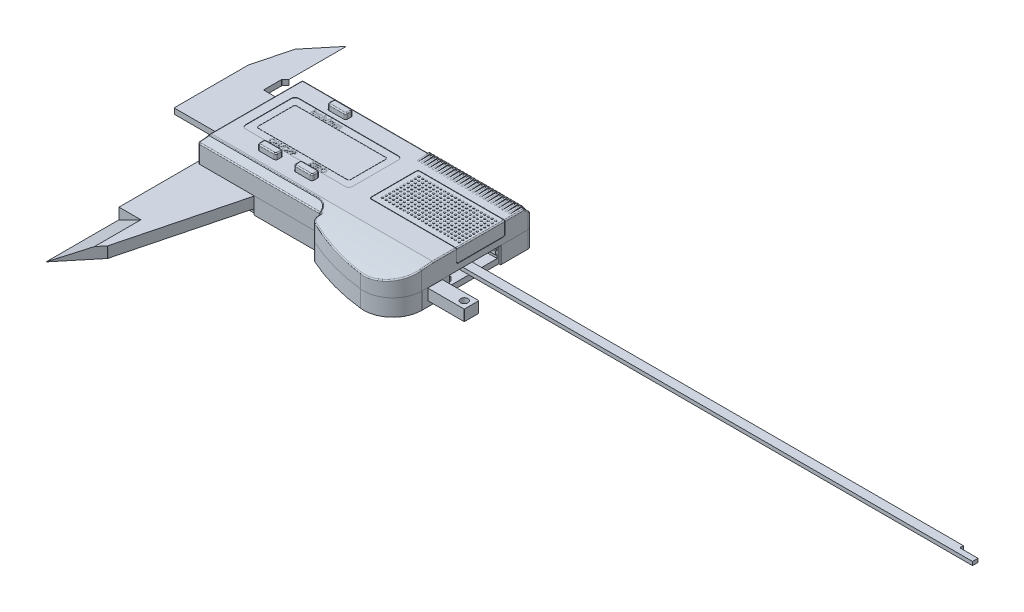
SolidWorks part; units mm, degrees
ref_plane "Front Plane" through (0, 0, 0) normal (0, 0, 1) x (1, 0, 0)
ref_plane "Top Plane" through (0, 0, 0) normal (0, 1, 0) x (1, 0, 0)
ref_plane "Right Plane" through (0, 0, 0) normal (1, 0, 0) x (0, 0, -1)
sketch "Sketch1" plane through (0, 0, 0) normal (0, 1, 0) x (1, 0, 0)
  line L0 (0, -2) -> (0, -13.5)
  line L1 (0, -13.5) -> (-1, -14.5)
  line L2 (-1, -14.5) -> (-1, -56.1)
  line L3 (-1, -56.1) -> (6.6336, -46.841)
  line L4 (6.6336, -46.841) -> (15, -14.5)
  line L5 (15, -14.5) -> (60, -14.5)
  line L6 (60, -14.5) -> (60, 14.5)
  line L7 (5.0002, 1.25) -> (18.5063, 1.25) construction
  line L8 (5.0002, -1.25) -> (18.5063, -1.25) construction
  line L9 (0, -2) -> (-20, -2)
  line L10 (-17.3613, 28.4842) -> (-20, 18.2842)
  line L11 (-20, -2) -> (-20, 18.2842)
  line L12 (-17.3613, 28.4842) -> (-11, 36.2)
  line L13 (-11, 36.2) -> (-11, 20.5)
  line L14 (-11, 20.5) -> (-12, 19.5)
  line L15 (60, 0) -> (0, 0) construction
  line L16 (60, 6.1) -> (-24.4785, 6.1) construction
  line L17 (-24.4785, 6.1) -> (-24.4785, -6.1) construction
  line L18 (-24.4785, -6.1) -> (60, -6.1) construction
  line L19 (-12, 19.5) -> (-12, 14.5)
  line L20 (-12, 14.5) -> (60, 14.5)
  dimension "D1" = 12.2
  dimension "D2" = 6.1
  dimension "D3" = 50
  dimension "D4" = 2.5
  dimension "D5" = 12
  dimension "D6" = 1
  dimension "D7" = 135
  dimension "D8" = 1.25
  dimension "D9" = 7.4
  dimension "D10" = 15
  dimension "D11" = 155
  dimension "D12" = 2
  dimension "D13" = 29
  dimension "D14" = 45
  dimension "D15" = 135
  dimension "D16" = 1
  dimension "D17" = 10
  dimension "D18" = 155
  dimension "D19" = 15.7
  dimension "D20" = 5
  dimension "D21" = 8
  dimension "D22" = 10
extrude "Boss-Extrude1" add sketch "Sketch1" along normal blind 5
sketch "Sketch2" plane through (0, 5, 0) normal (0, 1, 0) x (1, 0, 0)
  line L0 (0, -2) -> (0, 14.5)
  line L15 (0, -13.5) -> (-1, -14.5)
  line L16 (-1, -14.5) -> (-1, -56.1)
  line L17 (-1, -56.1) -> (6.6336, -46.841)
  line L18 (6.6336, -46.841) -> (15, -14.5)
  line L19 (15, -14.5) -> (60, -14.5)
  line L20 (60, -14.5) -> (60, 14.5)
  line L21 (60, 14.5) -> (-12, 14.5)
  line L22 (-12, 14.5) -> (-12, 19.5)
  line L23 (-12, 19.5) -> (-11, 20.5)
  line L24 (-11, 20.5) -> (-11, 36.2)
  line L25 (-11, 36.2) -> (-17.3613, 28.4842)
  line L26 (-17.3613, 28.4842) -> (-20, 18.2842)
  line L27 (-20, 18.2842) -> (-20, -2)
  line L28 (-20, -2) -> (0, -2)
  line L29 (0, -2) -> (0, -13.5)
  line L36 (0, 14.5) -> (-12, 14.5)
  line L37 (-12, 14.5) -> (-12, 19.5)
  line L38 (-12, 19.5) -> (-11, 20.5)
  line L39 (-11, 20.5) -> (-11, 36.2)
  line L40 (-11, 36.2) -> (-17.3613, 28.4842)
  line L41 (-17.3613, 28.4842) -> (-20, 18.2842)
  line L42 (-20, 18.2842) -> (-20, -2)
  line L43 (-20, -2) -> (0, -2)
  dimension "D1" = 0
extrude "Cut-Extrude1" cut sketch "Sketch2" against normal blind 3.5
sketch "Sketch3" plane through (60, 0, 0) normal (1, 0, 0) x (0, 0, -1)
  line L0 (0, 8.3658) -> (0, -4.7118) construction
  line L1 (-14.5, 5) -> (14.5, 5) construction
  line L2 (6.5, 1.5) -> (-6.5, 1.5)
  line L3 (6.5, 1.5) -> (6.5, 2.5)
  line L4 (6.5, 4.5) -> (-6.5, 4.5)
  line L5 (-6.5, 1.5) -> (-6.5, 2.5)
  line L6 (6.5, 1.5) -> (-6.5, 4.5) construction
  line L7 (6.5, 4.5) -> (-6.5, 1.5) construction
  line L8 (-6.1, 3) -> (0, 3) construction
  line L9 (-6.5, 3.5) -> (-6.1, 3.5)
  line L10 (6.5, 3.5) -> (6.5, 4.5)
  line L11 (-6.5, 2.5) -> (-6.1, 2.5)
  line L12 (-6.1, 3.5) -> (-6.1, 2.5)
  line L13 (6.5, 3.5) -> (6.1, 3.5)
  line L15 (6.5, 2.5) -> (6.1, 2.5)
  line L16 (6.1, 3.5) -> (6.1, 2.5)
  line L17 (0, 3) -> (6.1, 3) construction
  line L18 (-6.5, 3.5) -> (-6.5, 4.5)
  point P3 (0, 3)
  dimension "D1" = 3
  dimension "D2" = 13
  dimension "D3" = 0.5
  dimension "D4" = 0.4
  dimension "D5" = 0.4
  dimension "D6" = 1
  dimension "D7" = 1
extrude "Cut-Extrude2" cut sketch "Sketch3" against normal through all
fillet "Fillet1" radius 0.1 10 edges at (15, 2.5, 14.5) (6.6336, 2.5, 46.841) (-1, 2.5, 14.5) (0, 2.5, 13.5) (-20, 0.75, 2) (-12, 0.75, -14.5) (-20, 0.75, -18.2842) (-17.3613, 0.75, -28.4842) (-11, 0.75, -20.5) (-12, 0.75, -19.5)
ref_plane "Plane1" through (0, 0, 56.1) normal (0, 0, 1) x (1, 0, 0)
ref_plane "Plane2" through (0, 0, 36.1) normal (0, 0, 1) x (1, 0, 0)
ref_plane "Plane3" through (0, 0, -36.2) normal (0, 0, -1) x (-1, 0, 0)
ref_plane "Plane4" through (0, 0, -20.5) normal (0, 0, -1) x (-1, 0, 0)
sketch "Sketch5" plane through (0, 0, -20.5) normal (0, 0, -1) x (-1, 0, 0)
  line L0 (17.3472, 0) -> (11, 1.5)
  line L1 (11, 1.5) -> (11, 0)
  line L2 (11, 0) -> (17.3472, 0)
extrude "Cut-Extrude4" cut sketch "Sketch5" along normal through all
sketch "Sketch6" plane through (60, 0, 0) normal (1, 0, 0) x (0, 0, -1)
  line L0 (-14.5, 5) -> (-14.5, 0) construction
  line L1 (-14.5, 1.5) -> (-60.6201, 1.5)
  line L2 (-14.5, 1.5) -> (-14.5, -3.4615)
  line L3 (-14.5, -3.4615) -> (-60.6201, -3.4615)
  line L4 (-60.6201, 1.5) -> (-60.6201, -3.4615)
  line L5 (-14.5, 0) -> (14.5, 0) construction
  dimension "D1" = 1.5
extrude "Cut-Extrude5" cut sketch "Sketch6" against normal through all
fillet "Fillet2" radius 1 1 edges at (7.0432, 1.5, 14.5)
sketch "Sketch7" plane through (60, 0, 0) normal (1, 0, 0) x (0, 0, -1)
  line L0 (-14.5, 5) -> (-14.5, 0) construction
  line L1 (-14.5, 4.5) -> (-62.5532, 4.5)
  line L2 (-14.5, 4.5) -> (-14.5, 9.8508)
  line L3 (-14.5, 9.8508) -> (-62.5532, 9.8508)
  line L4 (-62.5532, 4.5) -> (-62.5532, 9.8508)
  line L5 (-46.8196, 5) -> (-14.575, 5) construction
  dimension "D1" = 0.5
extrude "Cut-Extrude6" cut sketch "Sketch7" against normal through all
sketch "Sketch8" plane through (0, 0, 36.1) normal (0, 0, 1) x (1, 0, 0)
  line L0 (-1, 1.5) -> (5, 4.5)
  line L1 (-0.991, 4.5) -> (15.0774, 4.5) construction
  line L2 (5, 4.5) -> (-1, 4.5)
  line L3 (-1, 4.5) -> (-1, 1.5)
  dimension "D1" = 6
extrude "Cut-Extrude7" cut sketch "Sketch8" along normal through all
sketch "Sketch9" plane through (60, 0, 0) normal (1, 0, 0) x (0, 0, -1)
  line L0 (0, 0) -> (0, 10.746) construction
  line L1 (-14.5, 0) -> (14.5, 0) construction
  line L2 (-14.5, 5) -> (14.5, 5) construction
  line L3 (-4.5, 5) -> (4.6, 5)
  line L4 (-4.5, 5) -> (-4.5, 4.5)
  line L5 (-4.5, 4.5) -> (4.6, 4.5)
  line L6 (4.6, 5) -> (4.6, 4.5)
  line L7 (6.5, 4.5) -> (-6.5, 4.5) construction
  dimension "D1" = 9.1
  dimension "D2" = 4.6
extrude "Cut-Extrude8" cut sketch "Sketch9" against normal through all
sketch "Sketch10" plane through (0, 1.5, 0) normal (0, 1, 0) x (1, 0, 0)
  line L0 (0, 0) -> (10.7209, 0) construction
  line L1 (0, 6.5) -> (0, 14.5) construction
  line L2 (8, 1.25) -> (193, 1.25)
  line L3 (8, 1.25) -> (8, -1.25)
  line L4 (8, -1.25) -> (198, -1.25)
  line L5 (198, 0.25) -> (198, -1.25)
  line L6 (198, 0.25) -> (193.3, 0.25)
  line L7 (193, 0.55) -> (193, 1.25)
  arc A0 (193.3, 0.25) -> (193, 0.55) centre (193.3, 0.55) cw
  dimension "D5" = 0.3
  dimension "D1" = 2.5
  dimension "D2" = 1.25
  dimension "D3" = 8
  dimension "D4" = 190
  dimension "D6" = 5
  dimension "D7" = 1.5
extrude "Boss-Extrude2" add sketch "Sketch10" along normal blind 1
sketch "Sketch11" plane through (0, 0, -14.5) normal (0, 0, -1) x (-1, 0, 0)
  line L1 (1, 4.5) -> (0, 4.5)
  line L2 (1, 4.5) -> (1, 5)
  line L3 (1, 5) -> (0, 5)
  line L4 (0, 4.5) -> (0, 5)
extrude "Cut-Extrude9" cut sketch "Sketch11" against normal through all
ref_plane "Plane5" through (0, 10, 0) normal (0, 1, 0) x (1, 0, 0)
sketch "Sketch12" plane through (0, 10, 0) normal (0, 1, 0) x (1, 0, 0)
  line L0 (-0.5, 14.5) -> (-0.5, -14.5)
  line L2 (0, -15) -> (33.2977, -15)
  line L3 (33.2977, -15) -> (33.2977, -16)
  line L4 (60.5, -14.7287) -> (60.5, 14.5)
  line L5 (59.5, 15.5) -> (40, 15.5)
  line L6 (40, 15.5) -> (39.5, 15)
  line L7 (39.5, 15) -> (24.5, 15)
  line L8 (24.5, 15) -> (24, 15.5)
  line L9 (24, 15.5) -> (0.5, 15.5)
  line L11 (0, 6.5) -> (0, 14.5) construction
  line L13 (0, 14.5) -> (0, 4.6) construction
  line L14 (60, -14.5) -> (60, -4.5) construction
  line L15 (0, -14.5) -> (60, -14.5) construction
  line L16 (60, 14.5) -> (0, 14.5) construction
  arc A0 (34.4754, -17.8231) -> (51.6182, -22.516) centre (57.9128, 34.1354) ccw
  arc A1 (51.6182, -22.516) -> (60.5, -14.7287) centre (52.5017, -14.5649) ccw
  arc A2 (33.2977, -16) -> (34.4754, -17.8231) centre (35.2977, -16) ccw
  arc A3 (60.5, 14.5) -> (59.5, 15.5) centre (59.5, 14.5) ccw
  arc A4 (0.5, 15.5) -> (-0.5, 14.5) centre (0.5, 14.5) ccw
  arc A5 (-0.5, -14.5) -> (0, -15) centre (0, -14.5) ccw
  dimension "D4" = 2
  dimension "D5" = 57
  dimension "D6" = 8
  dimension "D10" = 1
  dimension "D11" = 0.5
  dimension "D1" = 0.5
  dimension "D2" = 0.5
  dimension "D3" = 0.5
  dimension "D7" = 1
  dimension "D8" = 0.5
  dimension "D9" = 45
  dimension "D12" = 15
  dimension "D13" = 25
  dimension "D14" = 1
extrude "Boss-Extrude3" add sketch "Sketch12" against normal offset from surface (5.4 mm away) 0.1 separate body
sketch "Sketch13" plane through (0, 4.6, 0) normal (0, -1, 0) x (1, 0, 0)
  line L2 (-0.5, -14.5) -> (60.5, -14.5)
  line L3 (14.8707, 15) -> (15, 14.5)
  line L4 (-0.991, 14.5) -> (60, 14.5) construction
  line L5 (15, 14.5) -> (60.5, 14.5)
  line L9 (60.5, -14.5) -> (60.5, 14.7287)
  line L10 (33.2977, 16) -> (33.2977, 15)
  line L11 (33.2977, 15) -> (0, 15)
  line L12 (-0.5, 14.5) -> (-0.5, -14.5)
  line L13 (0.5, -15.5) -> (24, -15.5)
  line L14 (24, -15.5) -> (24.5, -15)
  line L15 (24.5, -15) -> (39.5, -15)
  line L16 (39.5, -15) -> (40, -15.5)
  line L17 (40, -15.5) -> (59.5, -15.5)
  line L18 (60.5, 14.5) -> (60.5, 14.7287)
  line L19 (33.2977, 16) -> (33.2977, 15)
  line L20 (33.2977, 15) -> (14.8707, 15)
  line L22 (0.5, -15.5) -> (24, -15.5)
  line L23 (24, -15.5) -> (24.5, -15)
  line L24 (24.5, -15) -> (39.5, -15)
  line L25 (39.5, -15) -> (40, -15.5)
  line L26 (40, -15.5) -> (59.5, -15.5)
  arc A6 (59.5, -15.5) -> (60.5, -14.5) centre (59.5, -14.5) ccw
  arc A7 (60.5, 14.7287) -> (51.6182, 22.516) centre (52.5017, 14.5649) ccw
  arc A8 (51.6182, 22.516) -> (34.4754, 17.8231) centre (57.9128, -34.1354) ccw
  arc A9 (34.4754, 17.8231) -> (33.2977, 16) centre (35.2977, 16) ccw
  arc A10 (0, 15) -> (-0.5, 14.5) centre (0, 14.5) ccw
  arc A11 (-0.5, -14.5) -> (0.5, -15.5) centre (0.5, -14.5) ccw
  arc A12 (59.5, -15.5) -> (60.5, -14.5) centre (59.5, -14.5) ccw
  arc A13 (60.5, 14.7287) -> (51.6182, 22.516) centre (52.5017, 14.5649) ccw
  arc A14 (51.6182, 22.516) -> (34.4754, 17.8231) centre (57.9128, -34.1354) ccw
  arc A15 (34.4754, 17.8231) -> (33.2977, 16) centre (35.2977, 16) ccw
  arc A17 (-0.5, -14.5) -> (0.5, -15.5) centre (0.5, -14.5) ccw
  dimension "D1" = 0
extrude "Boss-Extrude4" add sketch "Sketch13" along normal up to surface (4.6 mm away) separate body
sketch "Sketch14" plane through (0, 4.6, 0) normal (0, -1, 0) x (1, 0, 0)
  line L1 (60.5, 14.5) -> (60.0034, 14.5)
  line L2 (60.5, 14.5) -> (60.5, 7)
  line L3 (60.5, 7) -> (60.0034, 7)
  line L4 (60.0034, 14.5) -> (60.0034, 7)
  line L5 (60.5, -14.5) -> (60.0034, -14.5)
  line L6 (60.5, -14.5) -> (60.5, -7)
  line L7 (60.5, -7) -> (60.0034, -7)
  line L8 (60.0034, -14.5) -> (60.0034, -7)
  dimension "D1" = 7.5
  dimension "D2" = 7.5
extrude "Boss-Extrude5" add sketch "Sketch14" along normal up to surface (4.6 mm away) separate body
sketch "Sketch15" plane through (-0.5, 0, 0) normal (-1, 0, 0) x (0, 0, 1)
  line L0 (-15.5, 8) -> (-13.5, 10)
  line L1 (-15.5, 4.6) -> (-15.5, 10) construction
  line L2 (-14.5, 10) -> (14.5, 10) construction
  line L3 (-13.5, 10) -> (-15.5, 10)
  line L4 (-15.5, 10) -> (-15.5, 8)
  dimension "D1" = 2
  dimension "D2" = 2
extrude "Cut-Extrude10" cut sketch "Sketch15" against normal through all
sketch "Sketch16" plane through (60.5, 0, 0) normal (1, 0, 0) x (0, 0, -1)
  line L1 (-11.5244, 10) -> (-23.0267, 10)
  line L2 (-23.0267, 10) -> (-23.0267, 8.264)
  line L3 (-14.7287, 10) -> (13.5, 10) construction
  arc A0 (-23.0267, 8.264) -> (-11.5244, 10) centre (-6.7822, -60.3965) cw
extrude "Cut-Extrude11" cut sketch "Sketch16" against normal up to vertex
sketch "Sketch17" plane through (33.2977, 0, 0) normal (1, 0, 0) x (0, 0, -1)
  line L2 (-15, 10) -> (-15, 9.6793)
  line L3 (-11.5244, 10) -> (-15, 10)
  line L4 (-15, 10) -> (-15, 9.6793)
  line L5 (-11.5244, 10) -> (-15, 10)
  arc A1 (-11.5244, 10) -> (-15, 9.6793) centre (-6.7822, -60.3965) ccw
  arc A2 (-11.5244, 10) -> (-15, 9.6793) centre (-6.7822, -60.3965) ccw
  dimension "D1" = 0
extrude "Cut-Extrude12" cut sketch "Sketch17" against normal through all
fillet "Fillet3" radius 0.3 13 edges at (12.25, 8, -15.5) (-0.5, 9.5, -14) (33.2977, 9.6189, 15.5002) (56.6751, 8.6308, 21.39) (-0.5, 9.8838, 13.0136) (-0.3892, 9.7009, 14.8138) (39.75, 8.25, -15.25) (32, 8.5, -15) (24.25, 8.25, -15.25) (-0.2071, 8.2929, -15.2071) (33.7435, 9.3774, 17.2587) (16.6489, 9.6793, 15)
fillet "Fillet4" radius 0.3 16 edges at (24.4352, 8.4905, -14.9772) (24.4964, 8.334, -15) (23.9352, 7.9905, -15.4772) (39.5648, 8.4905, -14.9772) (39.5036, 8.334, -15) (-0.4121, 9.9121, -13.4636) (30, 10, -13.5) (60.4121, 9.9121, -13.5879) (60.5, 9.35, -14.15) (60.2071, 8.2929, -15.2071) (40, 6.1939, -15.5) (40.0568, 7.9432, -15.5) (24.5, 6.4439, -15) (24, 6.1939, -15.5) (39.5, 6.4439, -15) (49.8561, 8, -15.5)
fillet "Fillet5" radius 0.3 4 edges at (24, 2.3, -15.5) (24.5, 2.3, -15) (39.5, 2.3, -15) (40, 2.3, -15.5)
fillet "Fillet6" radius 0.5 3 edges at (33.359, 9.5651, 14.9579) (33.2977, 6.9886, 15)
fillet "Fillet7" radius 0.5 1 edges at (33.2977, 2.3, 15)
ref_plane "Plane6" through (59.5, 0, 0) normal (1, 0, 0) x (0, 0, -1)
sketch "Sketch18" plane through (59.5, 0, 0) normal (1, 0, 0) x (0, 0, -1)
  line L0 (10.2694, 10) -> (13.6898, 10.3035)
  line L1 (-11.5244, 10) -> (13.3757, 10) construction
  line L2 (13.6898, 10.3035) -> (14.5768, 8.9232)
  line L3 (13.5879, 9.9121) -> (14.7121, 8.7879) construction
  line L4 (13.5879, 9.9121) -> (14.5768, 8.9232)
  line L5 (10.2694, 10) -> (13.3757, 10)
  arc A0 (13.5879, 9.9121) -> (13.3757, 10) centre (13.3757, 9.7) ccw construction
  arc A1 (13.5879, 9.9121) -> (13.3757, 10) centre (13.3757, 9.7) ccw
extrude "Boss-Extrude6" add sketch "Sketch18" along normal mid plane 0.4
fillet "Fillet8" radius 0.5 1 edges at (59.5, 10.3035, -13.6898)
pattern_linear "LPattern1" count 26 spacing 1 along (-1, 0, 0) of "Boss-Extrude6", "Fillet8"
sketch "Sketch20" plane through (0, 10, 0) normal (0, 1, 0) x (1, 0, 0)
  line L0 (-0.2, -11.5244) -> (30.2936, -11.5244) construction
  line L1 (-0.2, -11.5244) -> (60.2, -11.5244) construction
ref_plane "Plane7" through (0, 10.7533, 0.7519) normal (0, -0.9976, -0.0698) x (1, 0, 0)
ref_plane "Plane8" through (0, 10.9528, 0.7659) normal (0, -0.9976, -0.0698) x (1, 0, 0)
sketch "Sketch22" plane through (0, 10.9528, 0.7659) normal (0, -0.9976, -0.0698) x (1, 0, 0)
  line L0 (-2.0943, 11.4203) -> (28.9927, 11.4203)
  line L1 (33.0646, 16.1969) -> (-2.0943, 16.1969)
  line L2 (-2.0943, 16.1969) -> (-2.0943, 11.4203)
  spline S0 degree 3 poles (28.9927, 11.4203) (29.9122, 11.4203) (32.2447, 11.9173) (33.3186, 14.7434) (33.0646, 16.1969) knots 0 0 0 0 0.347417 1 1 1 1
extrude "Cut-Extrude14" cut sketch "Sketch22" along normal offset from surface (0.4933 mm away) 0.1
fillet "Fillet9" radius 0.3 2 edges at (30.9056, 9.9274, 12.5011) (14.3964, 9.9555, 12.1444)
fillet "Fillet10" radius 0.3 1 edges at (-0.4236, 9.7546, 13.3306)
sketch "Sketch23" plane through (0, 10, 0) normal (0, 1, 0) x (1, 0, 0)
  line L1 (3.2795, -5.7127) -> (30.5918, -5.7127)
  line L2 (2.2795, -4.7127) -> (2.2795, 7.8424)
  line L3 (3.2795, 8.8424) -> (30.5918, 8.8424)
  line L4 (31.5918, -4.7127) -> (31.5918, 7.8424)
  arc A0 (30.5918, 8.8424) -> (31.5918, 7.8424) centre (30.5918, 7.8424) cw
  arc A1 (30.5918, -5.7127) -> (31.5918, -4.7127) centre (30.5918, -4.7127) ccw
  arc A2 (3.2795, -5.7127) -> (2.2795, -4.7127) centre (3.2795, -4.7127) cw
  arc A3 (2.2795, 7.8424) -> (3.2795, 8.8424) centre (3.2795, 7.8424) cw
  dimension "D1" = 1
extrude "Cut-Extrude15" cut sketch "Sketch23" against normal blind 0.1
sketch "Sketch24" plane through (0, 9.9, 0) normal (0, 1, 0) x (1, 0, 0)
  line L24 (29.5918, -3.7127) -> (29.5918, 6.8424)
  line L25 (4.2795, -3.7127) -> (29.5918, -3.7127)
  line L26 (4.2795, 6.8424) -> (4.2795, -3.7127)
  line L27 (29.5918, 6.8424) -> (4.2795, 6.8424)
  line L28 (29.5918, -3.2127) -> (29.5918, 6.3424)
  line L29 (4.7795, -3.7127) -> (29.0918, -3.7127)
  line L30 (4.2795, 6.3424) -> (4.2795, -3.2127)
  line L31 (29.0918, 6.8424) -> (4.7795, 6.8424)
  arc A16 (4.7795, -3.7127) -> (4.2795, -3.2127) centre (4.7795, -3.2127) cw
  arc A17 (29.5918, -3.2127) -> (29.0918, -3.7127) centre (29.0918, -3.2127) cw
  arc A18 (29.5918, 6.3424) -> (29.0918, 6.8424) centre (29.0918, 6.3424) ccw
  arc A19 (4.2795, 6.3424) -> (4.7795, 6.8424) centre (4.7795, 6.3424) cw
  dimension "D2" = 0.5
  dimension "D1" = 2
extrude "Cut-Extrude-Thin1" cut sketch "Sketch24" against normal mid plane 0.1 thin
sketch "Sketch25" plane through (0, 10, 0) normal (0, 1, 0) x (1, 0, 0)
  line L1 (10.3789, -9.0174) -> (14.3789, -9.0174)
  line L2 (9.8789, -8.5174) -> (9.8789, -7.5174)
  line L3 (10.3789, -7.0174) -> (14.3789, -7.0174)
  line L4 (14.8789, -8.5174) -> (14.8789, -7.5174)
  line L5 (9.8789, -9.0174) -> (14.8789, -7.0174) construction
  line L6 (9.8789, -7.0174) -> (14.8789, -9.0174) construction
  line L7 (20.3086, -9.0174) -> (24.3086, -9.0174)
  line L8 (19.8086, -8.5174) -> (19.8086, -7.5174)
  line L9 (20.3086, -7.0174) -> (24.3086, -7.0174)
  line L10 (24.8086, -8.5174) -> (24.8086, -7.5174)
  line L11 (19.8086, -9.0174) -> (24.8086, -7.0174) construction
  line L12 (19.8086, -7.0174) -> (24.8086, -9.0174) construction
  line L13 (14.3789, 10.1057) -> (10.3789, 10.1057)
  line L14 (14.8789, 10.6057) -> (14.8789, 11.6057)
  line L15 (14.3789, 12.1057) -> (10.3789, 12.1057)
  line L16 (9.8789, 10.6057) -> (9.8789, 11.6057)
  line L17 (14.8789, 10.1057) -> (9.8789, 12.1057) construction
  line L18 (14.8789, 12.1057) -> (9.8789, 10.1057) construction
  arc A0 (20.3086, -9.0174) -> (19.8086, -8.5174) centre (20.3086, -8.5174) cw
  arc A1 (24.3086, -7.0174) -> (24.8086, -7.5174) centre (24.3086, -7.5174) cw
  arc A2 (24.3086, -9.0174) -> (24.8086, -8.5174) centre (24.3086, -8.5174) ccw
  arc A3 (19.8086, -7.5174) -> (20.3086, -7.0174) centre (20.3086, -7.5174) cw
  arc A4 (14.3789, -9.0174) -> (14.8789, -8.5174) centre (14.3789, -8.5174) ccw
  arc A5 (14.3789, -7.0174) -> (14.8789, -7.5174) centre (14.3789, -7.5174) cw
  arc A6 (9.8789, -7.5174) -> (10.3789, -7.0174) centre (10.3789, -7.5174) cw
  arc A7 (10.3789, -9.0174) -> (9.8789, -8.5174) centre (10.3789, -8.5174) cw
  arc A8 (14.8789, 11.6057) -> (14.3789, 12.1057) centre (14.3789, 11.6057) ccw
  arc A9 (14.3789, 10.1057) -> (14.8789, 10.6057) centre (14.3789, 10.6057) ccw
  arc A10 (10.3789, 10.1057) -> (9.8789, 10.6057) centre (10.3789, 10.6057) cw
  arc A11 (10.3789, 12.1057) -> (9.8789, 11.6057) centre (10.3789, 11.6057) ccw
  point P0 (12.3789, -8.0174)
  point P5 (22.3086, -8.0174)
  point P36 (12.3789, 11.1057)
  dimension "D5" = 0.5
  dimension "D8" = 0.5
  dimension "D1" = 5
  dimension "D2" = 5
  dimension "D3" = 2
  dimension "D4" = 2
  dimension "D6" = 5
  dimension "D7" = 2
extrude "Boss-Extrude8" add sketch "Sketch25" along normal blind 1.5
sketch "Sketch26" plane through (0, 11.5, 0) normal (0, 1, 0) x (1, 0, 0)
  line L0 (14.3789, 12.1557) -> (10.3789, 12.1557)
  line L1 (9.8289, 11.6057) -> (9.8289, 10.6057)
  line L2 (10.3789, 10.0557) -> (14.3789, 10.0557)
  line L3 (14.9289, 10.6057) -> (14.9289, 11.6057)
  line L4 (14.3789, 12.1057) -> (10.3789, 12.1057)
  line L5 (9.8789, 11.6057) -> (9.8789, 10.6057)
  line L6 (10.3789, 10.1057) -> (14.3789, 10.1057)
  line L7 (14.8789, 10.6057) -> (14.8789, 11.6057)
  line L8 (14.3789, 12.1057) -> (10.3789, 12.1057)
  line L9 (9.8789, 11.6057) -> (9.8789, 10.6057)
  line L10 (10.3789, 10.1057) -> (14.3789, 10.1057)
  line L11 (14.8789, 10.6057) -> (14.8789, 11.6057)
  line L12 (14.8789, -8.5174) -> (14.8789, -7.5174)
  line L13 (14.3789, -7.0174) -> (10.3789, -7.0174)
  line L14 (9.8789, -7.5174) -> (9.8789, -8.5174)
  line L15 (10.3789, -9.0174) -> (14.3789, -9.0174)
  line L16 (14.8789, -8.5174) -> (14.8789, -7.5174)
  line L17 (14.3789, -7.0174) -> (10.3789, -7.0174)
  line L18 (9.8789, -7.5174) -> (9.8789, -8.5174)
  line L19 (10.3789, -9.0174) -> (14.3789, -9.0174)
  line L20 (20.3086, -9.0174) -> (24.3086, -9.0174)
  line L21 (24.8086, -8.5174) -> (24.8086, -7.5174)
  line L22 (24.3086, -7.0174) -> (20.3086, -7.0174)
  line L23 (19.8086, -7.5174) -> (19.8086, -8.5174)
  line L24 (20.3086, -9.0174) -> (24.3086, -9.0174)
  line L25 (24.8086, -8.5174) -> (24.8086, -7.5174)
  line L26 (24.3086, -7.0174) -> (20.3086, -7.0174)
  line L27 (19.8086, -7.5174) -> (19.8086, -8.5174)
  line L28 (10.3789, -9.0674) -> (14.3789, -9.0674)
  line L29 (14.9289, -8.5174) -> (14.9289, -7.5174)
  line L30 (14.3789, -6.9674) -> (10.3789, -6.9674)
  line L31 (9.8289, -7.5174) -> (9.8289, -8.5174)
  line L32 (19.7586, -7.5174) -> (19.7586, -8.5174)
  line L33 (20.3086, -9.0674) -> (24.3086, -9.0674)
  line L34 (24.8586, -8.5174) -> (24.8586, -7.5174)
  line L35 (24.3086, -6.9674) -> (20.3086, -6.9674)
  arc A0 (10.3789, 12.1557) -> (9.8289, 11.6057) centre (10.3789, 11.6057) ccw
  arc A1 (9.8289, 10.6057) -> (10.3789, 10.0557) centre (10.3789, 10.6057) ccw
  arc A2 (14.3789, 10.0557) -> (14.9289, 10.6057) centre (14.3789, 10.6057) ccw
  arc A3 (14.9289, 11.6057) -> (14.3789, 12.1557) centre (14.3789, 11.6057) ccw
  arc A4 (14.8789, 11.6057) -> (14.3789, 12.1057) centre (14.3789, 11.6057) ccw
  arc A5 (10.3789, 12.1057) -> (9.8789, 11.6057) centre (10.3789, 11.6057) ccw
  arc A6 (9.8789, 10.6057) -> (10.3789, 10.1057) centre (10.3789, 10.6057) ccw
  arc A7 (14.3789, 10.1057) -> (14.8789, 10.6057) centre (14.3789, 10.6057) ccw
  arc A8 (14.8789, 11.6057) -> (14.3789, 12.1057) centre (14.3789, 11.6057) ccw
  arc A9 (10.3789, 12.1057) -> (9.8789, 11.6057) centre (10.3789, 11.6057) ccw
  arc A10 (9.8789, 10.6057) -> (10.3789, 10.1057) centre (10.3789, 10.6057) ccw
  arc A11 (14.3789, 10.1057) -> (14.8789, 10.6057) centre (14.3789, 10.6057) ccw
  arc A12 (14.3789, -9.0174) -> (14.8789, -8.5174) centre (14.3789, -8.5174) ccw
  arc A13 (14.8789, -7.5174) -> (14.3789, -7.0174) centre (14.3789, -7.5174) ccw
  arc A14 (10.3789, -7.0174) -> (9.8789, -7.5174) centre (10.3789, -7.5174) ccw
  arc A15 (9.8789, -8.5174) -> (10.3789, -9.0174) centre (10.3789, -8.5174) ccw
  arc A16 (14.3789, -9.0174) -> (14.8789, -8.5174) centre (14.3789, -8.5174) ccw
  arc A17 (14.8789, -7.5174) -> (14.3789, -7.0174) centre (14.3789, -7.5174) ccw
  arc A18 (10.3789, -7.0174) -> (9.8789, -7.5174) centre (10.3789, -7.5174) ccw
  arc A19 (9.8789, -8.5174) -> (10.3789, -9.0174) centre (10.3789, -8.5174) ccw
  arc A20 (19.8086, -8.5174) -> (20.3086, -9.0174) centre (20.3086, -8.5174) ccw
  arc A21 (24.3086, -9.0174) -> (24.8086, -8.5174) centre (24.3086, -8.5174) ccw
  arc A22 (24.8086, -7.5174) -> (24.3086, -7.0174) centre (24.3086, -7.5174) ccw
  arc A23 (20.3086, -7.0174) -> (19.8086, -7.5174) centre (20.3086, -7.5174) ccw
  arc A24 (19.8086, -8.5174) -> (20.3086, -9.0174) centre (20.3086, -8.5174) ccw
  arc A25 (24.3086, -9.0174) -> (24.8086, -8.5174) centre (24.3086, -8.5174) ccw
  arc A26 (24.8086, -7.5174) -> (24.3086, -7.0174) centre (24.3086, -7.5174) ccw
  arc A27 (20.3086, -7.0174) -> (19.8086, -7.5174) centre (20.3086, -7.5174) ccw
  arc A28 (9.8289, -8.5174) -> (10.3789, -9.0674) centre (10.3789, -8.5174) ccw
  arc A29 (14.3789, -9.0674) -> (14.9289, -8.5174) centre (14.3789, -8.5174) ccw
  arc A30 (14.9289, -7.5174) -> (14.3789, -6.9674) centre (14.3789, -7.5174) ccw
  arc A31 (10.3789, -6.9674) -> (9.8289, -7.5174) centre (10.3789, -7.5174) ccw
  arc A32 (20.3086, -6.9674) -> (19.7586, -7.5174) centre (20.3086, -7.5174) ccw
  arc A33 (19.7586, -8.5174) -> (20.3086, -9.0674) centre (20.3086, -8.5174) ccw
  arc A34 (24.3086, -9.0674) -> (24.8586, -8.5174) centre (24.3086, -8.5174) ccw
  arc A35 (24.8586, -7.5174) -> (24.3086, -6.9674) centre (24.3086, -7.5174) ccw
  dimension "D1" = 0
  dimension "D2" = 0
  dimension "D3" = 0
  dimension "D4" = 0.05
extrude "Cut-Extrude16" cut sketch "Sketch26" against normal blind 2
fillet "Fillet11" radius 0.3 24 edges at (19.8086, 11.5, 8.0174) (19.955, 11.5, 7.1639) (22.3086, 11.5, 7.0174) (24.6621, 11.5, 7.1639) (24.8086, 11.5, 8.0174) (24.6621, 11.5, 8.871) (22.3086, 11.5, 9.0174) (19.955, 11.5, 8.871) (12.3789, 11.5, 9.0174) (10.0253, 11.5, 8.871) (9.8789, 11.5, 8.0174) (10.0253, 11.5, 7.1639) (12.3789, 11.5, 7.0174) (14.7324, 11.5, 7.1639) (14.8789, 11.5, 8.0174) (14.7324, 11.5, 8.871) (14.8789, 11.5, -11.1057) (14.7324, 11.5, -10.2521) (12.3789, 11.5, -10.1057) (10.0253, 11.5, -10.2521) (9.8789, 11.5, -11.1057) (10.0253, 11.5, -11.9593) (12.3789, 11.5, -12.1057) (14.7324, 11.5, -11.9593)
sketch "Sketch27" plane through (0, 0, -15) normal (0, 0, -1) x (-1, 0, 0)
  line L0 (-39.3757, 0) -> (-24.6243, 0) construction
  line L1 (-33.1243, 0) -> (-31.1243, 0)
  line L2 (-33.1243, 0) -> (-33.1243, 2.5)
  line L4 (-31.1243, 0) -> (-31.1243, 2.5)
  line L8 (-24.6243, 0) -> (-24.6243, 4.6) construction
  arc A0 (-33.1243, 2.5) -> (-31.1243, 2.5) centre (-32.1243, 2.5) cw
  dimension "D1" = 1
  dimension "D2" = 2.5
  dimension "D3" = 7.5
extrude "Cut-Extrude17" cut sketch "Sketch27" against normal up to next
sketch "Sketch28" plane through (0, 0, -14.5) normal (0, 0, -1) x (-1, 0, 0)
  circle A0 centre (-32.1243, 2.5) radius 0.6
  dimension "D1" = 1.2
extrude "Cut-Extrude18" cut sketch "Sketch28" against normal blind 1
sketch "Sketch29" plane through (60.5, 0, 0) normal (1, 0, 0) x (0, 0, -1)
  line L0 (-7, 4.6) -> (-14.5, 4.6) construction
  line L1 (-13, 1.5) -> (-9, 1.5)
  line L2 (-13, 1.5) -> (-13, 4.5)
  line L3 (-13, 4.5) -> (-9, 4.5)
  line L4 (-9, 1.5) -> (-9, 4.5)
  line L5 (-7, 0) -> (-7, 4.6) construction
  dimension "D1" = 3
  dimension "D2" = 0.1
  dimension "D3" = 4
  dimension "D4" = 2
extrude "Boss-Extrude9" add sketch "Sketch29" along normal blind 10
sketch "Sketch30" plane through (0, 4.5, 0) normal (0, 1, 0) x (1, 0, 0)
  line L0 (70.5, -11) -> (68.5, -11) construction
  line L1 (70.5, -9) -> (70.5, -13) construction
  circle A0 centre (68.5, -11) radius 1
  dimension "D1" = 2
  dimension "D2" = 2
extrude "Cut-Extrude19" cut sketch "Sketch30" against normal through all
sketch "Sketch31" plane through (0, 9.9, 0) normal (0, 1, 0) x (1, 0, 0)
  line L0 (8.0698, 7.2068) -> (16.4733, 7.2068) construction
  text T0 "<b>inch/mm</b>" font "Century Gothic" height in points 5
sketch "Sketch32" plane through (0, 9.9, 0) normal (0, 1, 0) x (1, 0, 0)
  line L0 (5.8776, -5.4452) -> (29.4225, -5.4452) construction
  text T0 "   <b>   ON/OFF        ZERO</b>" font "Century Gothic" height in points 5
extrude "Boss-Extrude10" add sketch "Sketch32" along normal blind 0.03
fillet "Fillet12" radius 0.1 2 edges at (70.5, 3, 9) (70.5, 3, 13)
sketch "Sketch33" plane through (0, 10, 0) normal (0, 1, 0) x (1, 0, 0)
  line L1 (61.5427, -5.0788) -> (37.2428, -5.0788)
  line L2 (61.5427, 8.0717) -> (61.5427, -5.0788)
  line L3 (61.5427, 8.0717) -> (37.2428, 8.0717)
  line L4 (36.7428, -4.5788) -> (36.7428, 7.5717)
  line L5 (36.6428, -4.6788) -> (36.6428, 7.6717)
  line L6 (61.6427, 8.1717) -> (37.1428, 8.1717)
  line L7 (61.6427, 8.1717) -> (61.6427, -5.1788)
  line L8 (61.6427, -5.1788) -> (37.1428, -5.1788)
  line L9 (61.5427, -5.0788) -> (36.7428, -5.0788) construction
  line L10 (36.7428, -5.0788) -> (36.7428, 8.0717) construction
  line L11 (36.6428, -5.1788) -> (36.6428, 8.1717) construction
  line L12 (61.6427, -5.1788) -> (36.6428, -5.1788) construction
  line L13 (61.5427, 8.0717) -> (36.7428, 8.0717) construction
  line L14 (61.6427, 8.1717) -> (36.6428, 8.1717) construction
  arc A0 (37.2428, -5.0788) -> (36.7428, -4.5788) centre (37.2428, -4.5788) cw
  arc A1 (36.6428, -4.6788) -> (37.1428, -5.1788) centre (37.1428, -4.6788) ccw
  arc A2 (37.2428, 8.0717) -> (36.7428, 7.5717) centre (37.2428, 7.5717) ccw
  arc A3 (36.6428, 7.6717) -> (37.1428, 8.1717) centre (37.1428, 7.6717) cw
  dimension "D2" = 0.5
  dimension "D1" = 0.1
extrude "Cut-Extrude21" cut sketch "Sketch33" against normal blind 0.5
sketch "Sketch35" plane through (60.5, 0, 0) normal (1, 0, 0) x (0, 0, -1)
  line L0 (-5.0788, 9.5) -> (-5.0788, 6.8417)
  line L1 (-4.5788, 6.3417) -> (7.5717, 6.3417)
  line L2 (8.0717, 6.8417) -> (8.0717, 9.5)
  line L3 (-5.1788, 9.5) -> (-5.1788, 6.7417)
  line L4 (-4.6788, 6.2417) -> (7.6717, 6.2417)
  line L5 (8.1717, 6.7417) -> (8.1717, 9.5)
  line L6 (-5.1788, 9.5) -> (-5.0788, 9.5)
  line L7 (8.0717, 9.5) -> (8.1717, 9.5)
  line L8 (-5.1788, 6.2417) -> (8.1717, 6.2417) construction
  line L9 (8.1717, 6.2417) -> (8.1717, 9.5) construction
  line L10 (-5.0788, 6.3417) -> (8.0717, 6.3417) construction
  line L11 (8.0717, 6.3417) -> (8.0717, 9.5) construction
  line L12 (-5.1788, 9.5) -> (-5.1788, 6.2417) construction
  line L13 (-5.0788, 9.5) -> (-5.0788, 6.3417) construction
  arc A0 (7.6717, 6.2417) -> (8.1717, 6.7417) centre (7.6717, 6.7417) ccw
  arc A1 (7.5717, 6.3417) -> (8.0717, 6.8417) centre (7.5717, 6.8417) ccw
  arc A2 (-5.1788, 6.7417) -> (-4.6788, 6.2417) centre (-4.6788, 6.7417) ccw
  arc A3 (-5.0788, 6.8417) -> (-4.5788, 6.3417) centre (-4.5788, 6.8417) ccw
  dimension "D2" = 0.5
  dimension "D1" = 0.1
extrude "Cut-Extrude22" cut sketch "Sketch35" against normal blind 0.5
sketch "Sketch36" plane through (0, 10, 0) normal (0, 1, 0) x (1, 0, 0)
  circle A0 centre (38.3933, 6.7095) radius 0.25
  circle A1 centre (39.3933, 6.7095) radius 0.25
  circle A2 centre (40.3933, 6.7095) radius 0.25
  circle A3 centre (41.3933, 6.7095) radius 0.25
  circle A4 centre (42.3933, 6.7095) radius 0.25
  circle A5 centre (43.3933, 6.7095) radius 0.25
  circle A6 centre (44.3933, 6.7095) radius 0.25
  circle A7 centre (45.3933, 6.7095) radius 0.25
  circle A8 centre (46.3933, 6.7095) radius 0.25
  circle A9 centre (47.3933, 6.7095) radius 0.25
  circle A10 centre (48.3933, 6.7095) radius 0.25
  circle A11 centre (49.3933, 6.7095) radius 0.25
  circle A12 centre (50.3933, 6.7095) radius 0.25
  circle A13 centre (51.3933, 6.7095) radius 0.25
  circle A14 centre (52.3933, 6.7095) radius 0.25
  circle A15 centre (53.3933, 6.7095) radius 0.25
  circle A16 centre (54.3933, 6.7095) radius 0.25
  circle A17 centre (55.3933, 6.7095) radius 0.25
  circle A18 centre (56.3933, 6.7095) radius 0.25
  circle A19 centre (57.3933, 6.7095) radius 0.25
  circle A20 centre (58.3933, 6.7095) radius 0.25
  circle A21 centre (59.3933, 6.7095) radius 0.25
  circle A22 centre (38.3933, 5.7095) radius 0.25
  circle A23 centre (39.3933, 5.7095) radius 0.25
  circle A24 centre (40.3933, 5.7095) radius 0.25
  circle A25 centre (41.3933, 5.7095) radius 0.25
  circle A26 centre (42.3933, 5.7095) radius 0.25
  circle A27 centre (43.3933, 5.7095) radius 0.25
  circle A28 centre (44.3933, 5.7095) radius 0.25
  circle A29 centre (45.3933, 5.7095) radius 0.25
  circle A30 centre (46.3933, 5.7095) radius 0.25
  circle A31 centre (47.3933, 5.7095) radius 0.25
  circle A32 centre (48.3933, 5.7095) radius 0.25
  circle A33 centre (49.3933, 5.7095) radius 0.25
  circle A34 centre (50.3933, 5.7095) radius 0.25
  circle A35 centre (51.3933, 5.7095) radius 0.25
  circle A36 centre (52.3933, 5.7095) radius 0.25
  circle A37 centre (53.3933, 5.7095) radius 0.25
  circle A38 centre (54.3933, 5.7095) radius 0.25
  circle A39 centre (55.3933, 5.7095) radius 0.25
  circle A40 centre (56.3933, 5.7095) radius 0.25
  circle A41 centre (57.3933, 5.7095) radius 0.25
  circle A42 centre (58.3933, 5.7095) radius 0.25
  circle A43 centre (59.3933, 5.7095) radius 0.25
  circle A44 centre (38.3933, 4.7095) radius 0.25
  circle A45 centre (39.3933, 4.7095) radius 0.25
  circle A46 centre (40.3933, 4.7095) radius 0.25
  circle A47 centre (41.3933, 4.7095) radius 0.25
  circle A48 centre (42.3933, 4.7095) radius 0.25
  circle A49 centre (43.3933, 4.7095) radius 0.25
  circle A50 centre (44.3933, 4.7095) radius 0.25
  circle A51 centre (45.3933, 4.7095) radius 0.25
  circle A52 centre (46.3933, 4.7095) radius 0.25
  circle A53 centre (47.3933, 4.7095) radius 0.25
  circle A54 centre (48.3933, 4.7095) radius 0.25
  circle A55 centre (49.3933, 4.7095) radius 0.25
  circle A56 centre (50.3933, 4.7095) radius 0.25
  circle A57 centre (51.3933, 4.7095) radius 0.25
  circle A58 centre (52.3933, 4.7095) radius 0.25
  circle A59 centre (53.3933, 4.7095) radius 0.25
  circle A60 centre (54.3933, 4.7095) radius 0.25
  circle A61 centre (55.3933, 4.7095) radius 0.25
  circle A62 centre (56.3933, 4.7095) radius 0.25
  circle A63 centre (57.3933, 4.7095) radius 0.25
  circle A64 centre (58.3933, 4.7095) radius 0.25
  circle A65 centre (59.3933, 4.7095) radius 0.25
  circle A66 centre (38.3933, 3.7095) radius 0.25
  circle A67 centre (39.3933, 3.7095) radius 0.25
  circle A68 centre (40.3933, 3.7095) radius 0.25
  circle A69 centre (41.3933, 3.7095) radius 0.25
  circle A70 centre (42.3933, 3.7095) radius 0.25
  circle A71 centre (43.3933, 3.7095) radius 0.25
  circle A72 centre (44.3933, 3.7095) radius 0.25
  circle A73 centre (45.3933, 3.7095) radius 0.25
  circle A74 centre (46.3933, 3.7095) radius 0.25
  circle A75 centre (47.3933, 3.7095) radius 0.25
  circle A76 centre (48.3933, 3.7095) radius 0.25
  circle A77 centre (49.3933, 3.7095) radius 0.25
  circle A78 centre (50.3933, 3.7095) radius 0.25
  circle A79 centre (51.3933, 3.7095) radius 0.25
  circle A80 centre (52.3933, 3.7095) radius 0.25
  circle A81 centre (53.3933, 3.7095) radius 0.25
  circle A82 centre (54.3933, 3.7095) radius 0.25
  circle A83 centre (55.3933, 3.7095) radius 0.25
  circle A84 centre (56.3933, 3.7095) radius 0.25
  circle A85 centre (57.3933, 3.7095) radius 0.25
  circle A86 centre (58.3933, 3.7095) radius 0.25
  circle A87 centre (59.3933, 3.7095) radius 0.25
  circle A88 centre (38.3933, 2.7095) radius 0.25
  circle A89 centre (39.3933, 2.7095) radius 0.25
  circle A90 centre (40.3933, 2.7095) radius 0.25
  circle A91 centre (41.3933, 2.7095) radius 0.25
  circle A92 centre (42.3933, 2.7095) radius 0.25
  circle A93 centre (43.3933, 2.7095) radius 0.25
  circle A94 centre (44.3933, 2.7095) radius 0.25
  circle A95 centre (45.3933, 2.7095) radius 0.25
  circle A96 centre (46.3933, 2.7095) radius 0.25
  circle A97 centre (47.3933, 2.7095) radius 0.25
  circle A98 centre (48.3933, 2.7095) radius 0.25
  circle A99 centre (49.3933, 2.7095) radius 0.25
  circle A100 centre (50.3933, 2.7095) radius 0.25
  circle A101 centre (51.3933, 2.7095) radius 0.25
  circle A102 centre (52.3933, 2.7095) radius 0.25
  circle A103 centre (53.3933, 2.7095) radius 0.25
  circle A104 centre (54.3933, 2.7095) radius 0.25
  circle A105 centre (55.3933, 2.7095) radius 0.25
  circle A106 centre (56.3933, 2.7095) radius 0.25
  circle A107 centre (57.3933, 2.7095) radius 0.25
  circle A108 centre (58.3933, 2.7095) radius 0.25
  circle A109 centre (59.3933, 2.7095) radius 0.25
  circle A110 centre (38.3933, 1.7095) radius 0.25
  circle A111 centre (39.3933, 1.7095) radius 0.25
  circle A112 centre (40.3933, 1.7095) radius 0.25
  circle A113 centre (41.3933, 1.7095) radius 0.25
  circle A114 centre (42.3933, 1.7095) radius 0.25
  circle A115 centre (43.3933, 1.7095) radius 0.25
  circle A116 centre (44.3933, 1.7095) radius 0.25
  circle A117 centre (45.3933, 1.7095) radius 0.25
  circle A118 centre (46.3933, 1.7095) radius 0.25
  circle A119 centre (47.3933, 1.7095) radius 0.25
  circle A120 centre (48.3933, 1.7095) radius 0.25
  circle A121 centre (49.3933, 1.7095) radius 0.25
  circle A122 centre (50.3933, 1.7095) radius 0.25
  circle A123 centre (51.3933, 1.7095) radius 0.25
  circle A124 centre (52.3933, 1.7095) radius 0.25
  circle A125 centre (53.3933, 1.7095) radius 0.25
  circle A126 centre (54.3933, 1.7095) radius 0.25
  circle A127 centre (55.3933, 1.7095) radius 0.25
  circle A128 centre (56.3933, 1.7095) radius 0.25
  circle A129 centre (57.3933, 1.7095) radius 0.25
  circle A130 centre (58.3933, 1.7095) radius 0.25
  circle A131 centre (59.3933, 1.7095) radius 0.25
  circle A132 centre (38.3933, 0.7095) radius 0.25
  circle A133 centre (39.3933, 0.7095) radius 0.25
  circle A134 centre (40.3933, 0.7095) radius 0.25
  circle A135 centre (41.3933, 0.7095) radius 0.25
  circle A136 centre (42.3933, 0.7095) radius 0.25
  circle A137 centre (43.3933, 0.7095) radius 0.25
  circle A138 centre (44.3933, 0.7095) radius 0.25
  circle A139 centre (45.3933, 0.7095) radius 0.25
  circle A140 centre (46.3933, 0.7095) radius 0.25
  circle A141 centre (47.3933, 0.7095) radius 0.25
  circle A142 centre (48.3933, 0.7095) radius 0.25
  circle A143 centre (49.3933, 0.7095) radius 0.25
  circle A144 centre (50.3933, 0.7095) radius 0.25
  circle A145 centre (51.3933, 0.7095) radius 0.25
  circle A146 centre (52.3933, 0.7095) radius 0.25
  circle A147 centre (53.3933, 0.7095) radius 0.25
  circle A148 centre (54.3933, 0.7095) radius 0.25
  circle A149 centre (55.3933, 0.7095) radius 0.25
  circle A150 centre (56.3933, 0.7095) radius 0.25
  circle A151 centre (57.3933, 0.7095) radius 0.25
  circle A152 centre (58.3933, 0.7095) radius 0.25
  circle A153 centre (59.3933, 0.7095) radius 0.25
  circle A154 centre (38.3933, -0.2905) radius 0.25
  circle A155 centre (39.3933, -0.2905) radius 0.25
  circle A156 centre (40.3933, -0.2905) radius 0.25
  circle A157 centre (41.3933, -0.2905) radius 0.25
  circle A158 centre (42.3933, -0.2905) radius 0.25
  circle A159 centre (43.3933, -0.2905) radius 0.25
  circle A160 centre (44.3933, -0.2905) radius 0.25
  circle A161 centre (45.3933, -0.2905) radius 0.25
  circle A162 centre (46.3933, -0.2905) radius 0.25
  circle A163 centre (47.3933, -0.2905) radius 0.25
  circle A164 centre (48.3933, -0.2905) radius 0.25
  circle A165 centre (49.3933, -0.2905) radius 0.25
  circle A166 centre (50.3933, -0.2905) radius 0.25
  circle A167 centre (51.3933, -0.2905) radius 0.25
  circle A168 centre (52.3933, -0.2905) radius 0.25
  circle A169 centre (53.3933, -0.2905) radius 0.25
  circle A170 centre (54.3933, -0.2905) radius 0.25
  circle A171 centre (55.3933, -0.2905) radius 0.25
  circle A172 centre (56.3933, -0.2905) radius 0.25
  circle A173 centre (57.3933, -0.2905) radius 0.25
  circle A174 centre (58.3933, -0.2905) radius 0.25
  circle A175 centre (59.3933, -0.2905) radius 0.25
  circle A176 centre (38.3933, -1.2905) radius 0.25
  circle A177 centre (39.3933, -1.2905) radius 0.25
  circle A178 centre (40.3933, -1.2905) radius 0.25
  circle A179 centre (41.3933, -1.2905) radius 0.25
  circle A180 centre (42.3933, -1.2905) radius 0.25
  circle A181 centre (43.3933, -1.2905) radius 0.25
  circle A182 centre (44.3933, -1.2905) radius 0.25
  circle A183 centre (45.3933, -1.2905) radius 0.25
  circle A184 centre (46.3933, -1.2905) radius 0.25
  circle A185 centre (47.3933, -1.2905) radius 0.25
  circle A186 centre (48.3933, -1.2905) radius 0.25
  circle A187 centre (49.3933, -1.2905) radius 0.25
  circle A188 centre (50.3933, -1.2905) radius 0.25
  circle A189 centre (51.3933, -1.2905) radius 0.25
  circle A190 centre (52.3933, -1.2905) radius 0.25
  circle A191 centre (53.3933, -1.2905) radius 0.25
  circle A192 centre (54.3933, -1.2905) radius 0.25
  circle A193 centre (55.3933, -1.2905) radius 0.25
  circle A194 centre (56.3933, -1.2905) radius 0.25
  circle A195 centre (57.3933, -1.2905) radius 0.25
  circle A196 centre (58.3933, -1.2905) radius 0.25
  circle A197 centre (59.3933, -1.2905) radius 0.25
  circle A198 centre (38.3933, -2.2905) radius 0.25
  circle A199 centre (39.3933, -2.2905) radius 0.25
  circle A200 centre (40.3933, -2.2905) radius 0.25
  circle A201 centre (41.3933, -2.2905) radius 0.25
  circle A202 centre (42.3933, -2.2905) radius 0.25
  circle A203 centre (43.3933, -2.2905) radius 0.25
  circle A204 centre (44.3933, -2.2905) radius 0.25
  circle A205 centre (45.3933, -2.2905) radius 0.25
  circle A206 centre (46.3933, -2.2905) radius 0.25
  circle A207 centre (47.3933, -2.2905) radius 0.25
  circle A208 centre (48.3933, -2.2905) radius 0.25
  circle A209 centre (49.3933, -2.2905) radius 0.25
  circle A210 centre (50.3933, -2.2905) radius 0.25
  circle A211 centre (51.3933, -2.2905) radius 0.25
  circle A212 centre (52.3933, -2.2905) radius 0.25
  circle A213 centre (53.3933, -2.2905) radius 0.25
  circle A214 centre (54.3933, -2.2905) radius 0.25
  circle A215 centre (55.3933, -2.2905) radius 0.25
  circle A216 centre (56.3933, -2.2905) radius 0.25
  circle A217 centre (57.3933, -2.2905) radius 0.25
  circle A218 centre (58.3933, -2.2905) radius 0.25
  circle A219 centre (59.3933, -2.2905) radius 0.25
  circle A220 centre (38.3933, -3.2905) radius 0.25
  circle A221 centre (39.3933, -3.2905) radius 0.25
  circle A222 centre (40.3933, -3.2905) radius 0.25
  circle A223 centre (41.3933, -3.2905) radius 0.25
  circle A224 centre (42.3933, -3.2905) radius 0.25
  circle A225 centre (43.3933, -3.2905) radius 0.25
  circle A226 centre (44.3933, -3.2905) radius 0.25
  circle A227 centre (45.3933, -3.2905) radius 0.25
  circle A228 centre (46.3933, -3.2905) radius 0.25
  circle A229 centre (47.3933, -3.2905) radius 0.25
  circle A230 centre (48.3933, -3.2905) radius 0.25
  circle A231 centre (49.3933, -3.2905) radius 0.25
  circle A232 centre (50.3933, -3.2905) radius 0.25
  circle A233 centre (51.3933, -3.2905) radius 0.25
  circle A234 centre (52.3933, -3.2905) radius 0.25
  circle A235 centre (53.3933, -3.2905) radius 0.25
  circle A236 centre (54.3933, -3.2905) radius 0.25
  circle A237 centre (55.3933, -3.2905) radius 0.25
  circle A238 centre (56.3933, -3.2905) radius 0.25
  circle A239 centre (57.3933, -3.2905) radius 0.25
  circle A240 centre (58.3933, -3.2905) radius 0.25
  circle A241 centre (59.3933, -3.2905) radius 0.25
  dimension "D1" = 0.5
  dimension "D2" = 22
  dimension "D3" = 11
extrude "Boss-Extrude11" add sketch "Sketch36" along normal blind 0.1
extrude "Boss-Extrude14" add sketch "Sketch31" along normal blind 0.01
